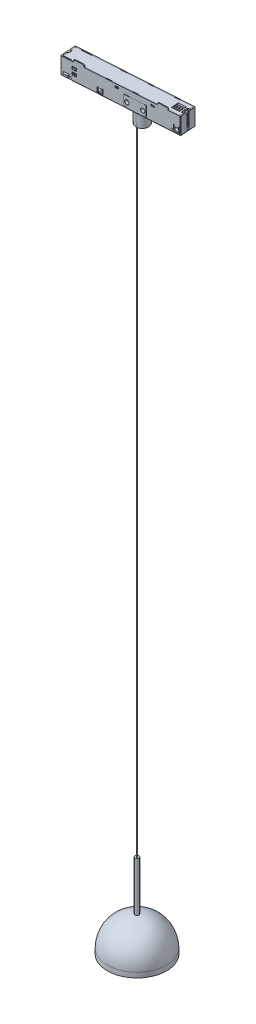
SolidWorks part; units mm, degrees
ref_plane "Alzado" through (0, 0, 0) normal (0, 0, 1) x (1, 0, 0)
ref_plane "Planta" through (0, 0, 0) normal (0, 1, 0) x (1, 0, 0)
ref_plane "Vista lateral" through (0, 0, 0) normal (1, 0, 0) x (0, 0, -1)
imported_body "TRACK_perfil-1-solid1"
imported_body "TRACK_perfil-1-solid2"
imported_body "TRACK_perfil-1-solid3"
imported_body "TRACK_perfil-1-solid4"
imported_body "TRACK_perfil-1-solid5"
imported_body "TRACK_perfil-1-solid6"
imported_body "TRACK_perfil-1-solid7"
imported_body "TRACK_perfil-1-solid8"
imported_body "TRACK_perfil-1-solid9"
imported_body "TRACK_perfil-1-solid10"
imported_body "TRACK_perfil-1-solid11"
imported_body "TRACK_perfil-1-solid12"
imported_body "TRACK_perfil-1-solid13"
imported_body "TRACK_perfil-1-solid14"
imported_body "TRACK_perfil-1-solid15"
imported_body "TRACK_perfil-1-solid16"
imported_body "TRACK_perfil-1-solid17"
imported_body "TRACK_perfil-1-solid18"
imported_body "TRACK_perfil-1-solid19"
imported_body "TRACK_perfil-1-solid20"
imported_body "TRACK_perfil-1-solid21"
imported_body "TRACK_perfil-1-solid22"
imported_body "TRACK_perfil-1-solid23"
imported_body "TRACK_perfil-1-solid24"
imported_body "TRACK_perfil-1-solid25"
imported_body "TRACK_perfil-1-solid26"
imported_body "TRACK_perfil-1-solid27"
imported_body "TRACK_perfil-1-surface1"
imported_body "HALF-1-solid1"
sketch "Croquis1" plane through (0, -719.0243, 0) normal (0, -1, 0) x (1, 0, 0)
  circle A0 centre (8.8652, 4.7868) radius 6.1641
sketch "Croquis3" plane through (0, -685.0243, 0) normal (0, 1, 0) x (1, 0, 0)
  circle A0 centre (8.8652, -4.7868) radius 2
extrude "Saliente-Extruir1" add sketch "Croquis3" against normal blind 4
sketch "Croquis4" plane through (0, -685.0243, 0) normal (0, 1, 0) x (1, 0, 0)
  circle A1 centre (8.8652, -4.7868) radius 2
  circle A2 centre (8.8652, -4.7868) radius 2
  dimension "D1" = 0
extrude "Saliente-Extruir2" add sketch "Croquis4" along normal blind 46
sketch "Croquis5" plane through (0, -719.0243, 0) normal (0, -1, 0) x (1, 0, 0)
  circle A1 centre (8.8652, 4.7868) radius 30
  circle A2 centre (8.8652, 4.7868) radius 30
  dimension "D1" = 0
extrude "Saliente-Extruir3" add sketch "Croquis5" along normal blind 5 separate body
sketch "Croquis6" plane through (0, -724.0243, 0) normal (0, -1, 0) x (1, 0, 0)
  circle A0 centre (8.8652, 4.7868) radius 25
  circle A1 centre (8.8652, 4.7868) radius 30 construction
  dimension "D1" = 5
extrude "Cortar-Extruir2" cut sketch "Croquis6" against normal blind 5 draft 46
extrude "Saliente-Extruir4" add sketch "Croquis1" against normal blind 3
